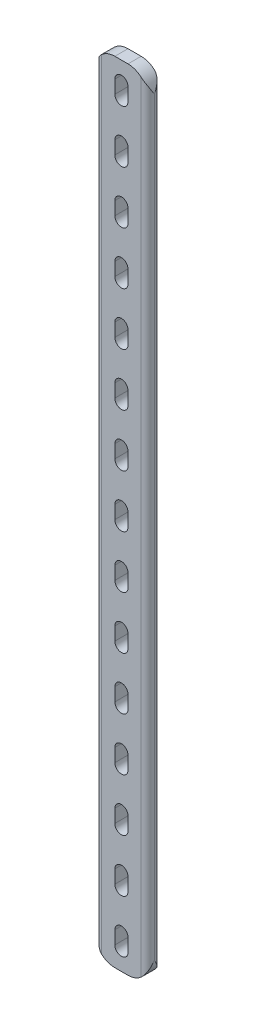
SolidWorks part; units mm, degrees
ref_plane "Front Plane" through (0, 0, 0) normal (0, 0, 1) x (1, 0, 0)
ref_plane "Top Plane" through (0, 0, 0) normal (0, 1, 0) x (1, 0, 0)
ref_plane "Right Plane" through (0, 0, 0) normal (1, 0, 0) x (0, 0, -1)
sketch "Sketch1" plane through (0, 0, 0) normal (0, 0, 1) x (1, 0, 0)
  line L1 (3.175, 190.5) -> (-3.175, 190.5)
  line L2 (12.7, 180.975) -> (12.7, -180.975)
  line L3 (3.175, -190.5) -> (-3.175, -190.5)
  line L4 (-12.7, 180.975) -> (-12.7, -180.975)
  line L5 (12.7, 190.5) -> (-12.7, -190.5) construction
  line L6 (12.7, -190.5) -> (-12.7, 190.5) construction
  arc A1 (12.7, -180.975) -> (3.175, -190.5) centre (3.175, -180.975) cw
  arc A2 (-3.175, -190.5) -> (-12.7, -180.975) centre (-3.175, -180.975) cw
  arc A3 (3.175, 190.5) -> (12.7, 180.975) centre (3.175, 180.975) cw
  arc A4 (-3.175, 190.5) -> (-12.7, 180.975) centre (-3.175, 180.975) ccw
  point P0 (0, 0)
  dimension "D3" = 9.525
  dimension "D1" = 25.4
  dimension "D2" = 381
extrude "Boss-Extrude1" add sketch "Sketch1" along normal blind 6.35
sketch "Sketch2" plane through (0, 0, 6.35) normal (0, 0, 1) x (1, 0, 0)
  line L0 (0, 180.975) -> (0, 174.625) construction
  line L1 (3.175, 180.975) -> (3.175, 174.625)
  line L2 (-3.175, 180.975) -> (-3.175, 174.625)
  line L3 (3.175, 190.5) -> (-3.175, 190.5) construction
  arc A0 (3.175, 180.975) -> (-3.175, 180.975) centre (0, 180.975) ccw
  arc A1 (-3.175, 174.625) -> (3.175, 174.625) centre (0, 174.625) ccw
  point P3 (0, 177.8)
  dimension "D1" = 9.525
  dimension "D2" = 6.35
  dimension "D3" = 6.35
extrude "Cut-Extrude1" cut sketch "Sketch2" against normal through all
pattern_linear "LPattern2" count 15 spacing 25.4 along (0, -1, 0) of "Cut-Extrude1"
fillet "Fillet1" radius 3.175 4 edges at (-12.7, 0, 0) (12.7, 0, 0) (-12.7, 0, 6.35) (12.7, 0, 6.35)
